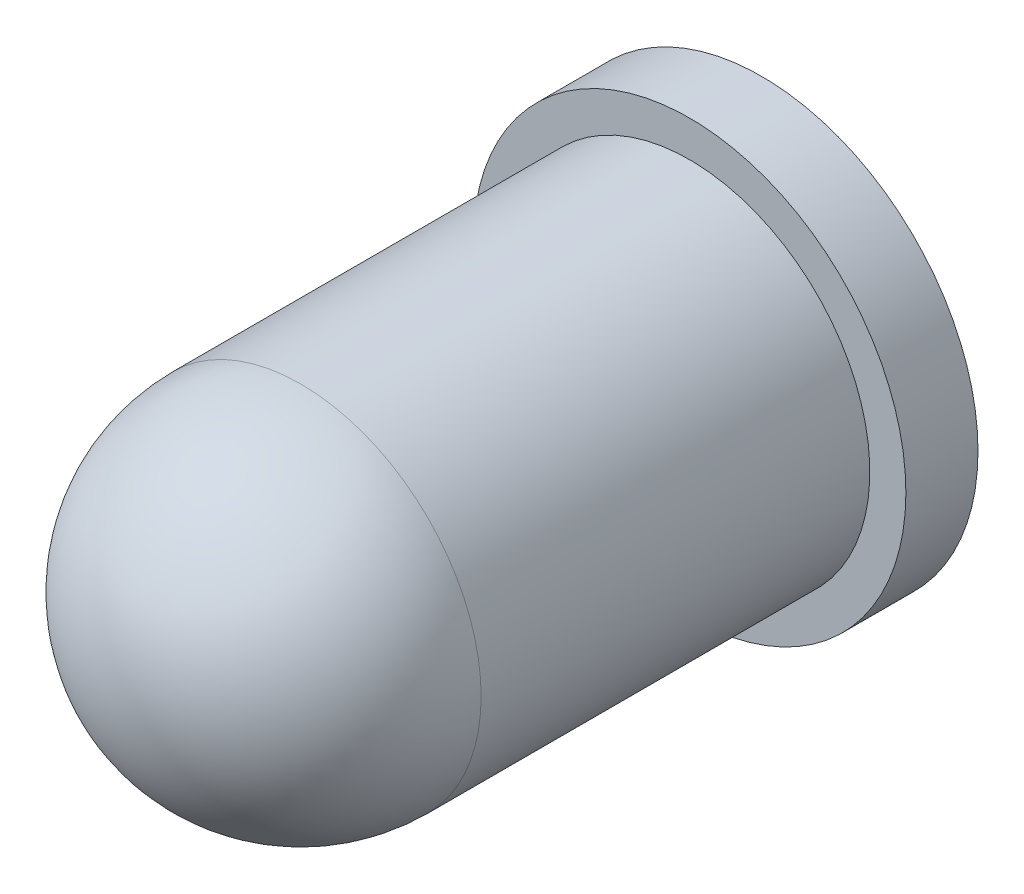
SolidWorks part; units mm, degrees
ref_plane "Front Plane" through (0, 0, 0) normal (0, 0, 1) x (1, 0, 0)
ref_plane "Top Plane" through (0, 0, 0) normal (0, 1, 0) x (1, 0, 0)
ref_plane "Right Plane" through (0, 0, 0) normal (1, 0, 0) x (0, 0, -1)
sketch "Sketch2" plane through (0, 0, 0) normal (1, 0, 0) x (0, 0, -1)
  line L0 (0, 0) -> (0, 3)
  line L1 (0, 3) -> (-1, 3)
  line L2 (-1, 3) -> (-1, 2.5)
  line L3 (-1, 2.5) -> (-6.39, 2.5)
  line L4 (-8.89, 0) -> (0, 0)
  line L5 (0, 0) -> (-22.8985, 0) construction
  line L6 (-8.89, 0) -> (-8.89, -0.6878) construction
  arc A0 (-6.39, 2.5) -> (-8.89, 0) centre (-6.39, 0) ccw
  dimension "D1" = 5
  dimension "D2" = 1
  dimension "D3" = 0.5
  dimension "D4" = 8.89
revolve "Revolve1" add sketch "Sketch2" angle 360 about L5
